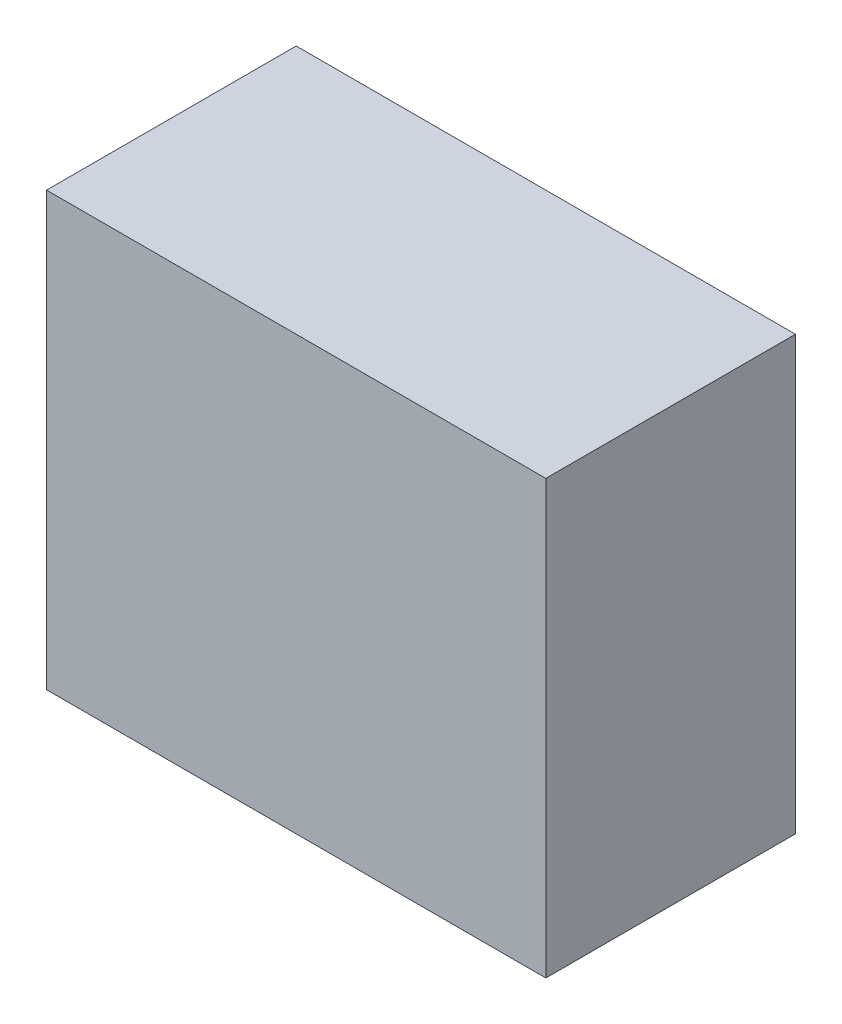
SolidWorks part; units mm, degrees
ref_plane "前视基准面" through (0, 0, 0) normal (0, 0, 1) x (1, 0, 0)
ref_plane "上视基准面" through (0, 0, 0) normal (0, 1, 0) x (1, 0, 0)
ref_plane "右视基准面" through (0, 0, 0) normal (1, 0, 0) x (0, 0, -1)
sketch "草图1" plane through (0, 0, 0) normal (0, 0, 1) x (1, 0, 0)
  line L0 (0, 1.3) -> (0, -1.3)
  line L1 (0, 1.3) -> (1.5, 1.3)
  line L3 (0, -1.3) -> (1.5, -1.3)
  line L4 (1.5, 1.3) -> (1.5, -1.3)
  line L5 (-1.5, 1.3) -> (1.5, -1.3) construction
  line L6 (-1.5, -1.3) -> (1.5, 1.3) construction
  point P0 (0, 0)
  dimension "D1" = 2.6
  dimension "D2" = 1.3
  dimension "D3" = 1.5
  dimension "D4" = 1.5
extrude "凸台-拉伸1" add sketch "草图1" along normal blind 1.5
sketch "草图2" plane through (0, 0, 1.5) normal (0, 0, 1) x (1, 0, 0)
  line L1 (0, 1.3) -> (-1.5, 1.3)
  line L2 (0, 1.3) -> (0, -1.3)
  line L3 (0, -1.3) -> (-1.5, -1.3)
  line L4 (-1.5, 1.3) -> (-1.5, -1.3)
  dimension "D1" = 2.6
  dimension "D2" = 1.5
extrude "凸台-拉伸2" add sketch "草图2" against normal blind 1.5
